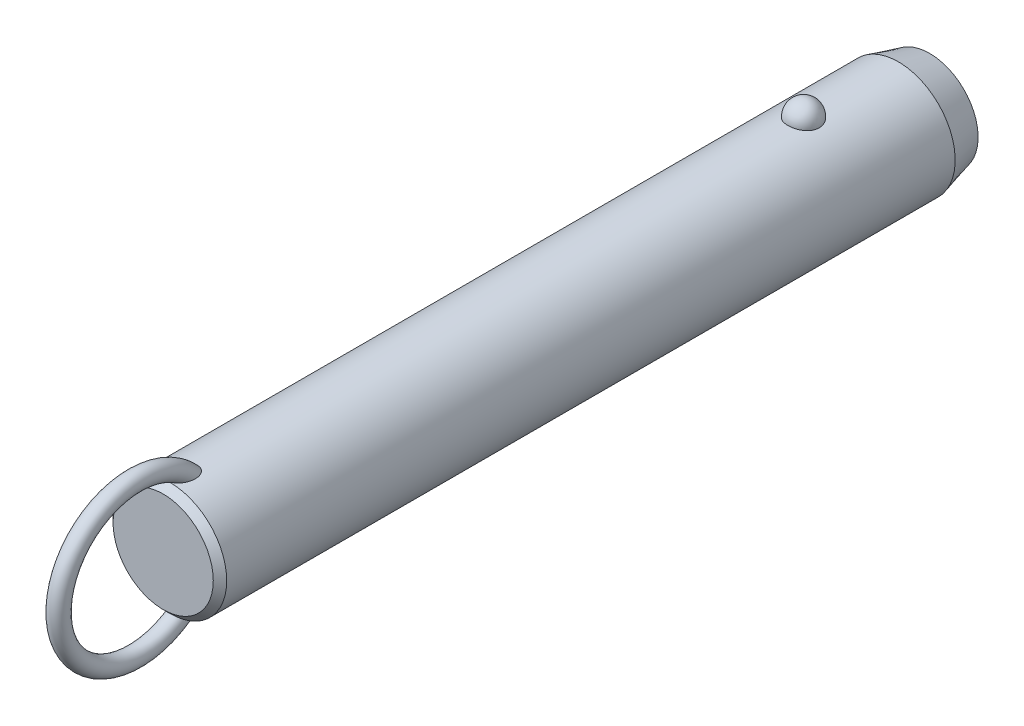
SolidWorks part; units mm, degrees
ref_plane "Front Plane" through (0, 0, 0) normal (0, 0, 1) x (1, 0, 0)
ref_plane "Top Plane" through (0, 0, 0) normal (0, 1, 0) x (1, 0, 0)
ref_plane "Right Plane" through (0, 0, 0) normal (1, 0, 0) x (0, 0, -1)
sketch "Sketch2" plane through (0, 0, 0) normal (0, 0, 1) x (1, 0, 0)
  circle A0 centre (0, 0) radius 12.7
  point P3 (0, 12.7)
  dimension "D1" = 25.4
extrude "Boss-Extrude1" add sketch "Sketch2" along normal blind 127
sketch "Sketch3" plane through (0, 0, 0) normal (0, 0, -1) x (-1, 0, 0)
  circle A0 centre (0, 0) radius 12.7
  dimension "D1" = 25.4
extrude "Boss-Extrude2" add sketch "Sketch3" along normal blind 31.7
chamfer "Chamfer1" distance 7 angle 15 1 edges at (-12.7, 0, -31.7)
sketch "Sketch12" plane through (0, 0, 0) normal (1, 0, 0) x (0, 0, -1)
  line L0 (-127, 12.7) -> (-127, -12.7) construction
  point P0 (-127, 0)
sketch "Sketch13" plane through (0, 0, 0) normal (1, 0, 0) x (0, 0, -1)
  circle A0 centre (-146.05, 0) radius 19.05
  point P2 (-127, 0)
  dimension "D1" = 38.1
sketch "Sketch14" plane through (0, 0, 0) normal (0, 1, 0) x (1, 0, 0)
  circle A0 centre (0, -129) radius 2
  point P2 (0, -127)
  dimension "D1" = 4
sweep "Sweep1" add profiles "Sketch14" path "Sketch13"
sketch "Sketch15" plane through (0, 0, 127) normal (0, 0, 1) x (1, 0, 0)
  circle A0 centre (0, 0) radius 12.7
  dimension "D1" = 25.4
extrude "Boss-Extrude3" add sketch "Sketch15" along normal blind 12.7
chamfer "Chamfer2" distance 1.5 angle 45 1 edges at (12.7, 0, 139.7)
sketch "Sketch18" plane through (0, 0, 0) normal (1, 0, 0) x (0, 0, -1)
  line L0 (24.7, 12.7) -> (-131.851, 12.7) construction
  line L1 (3.5, 16.2) -> (3.5, 9.2)
  line L2 (-131.851, -12.7) -> (24.7, -12.7) construction
  arc A0 (3.5, 16.2) -> (3.5, 9.2) centre (3.5, 12.7) ccw
  point P4 (0, 12.7)
  dimension "D1" = 28.9
revolve "Revolve1" add sketch "Sketch18" angle 360 about L1
